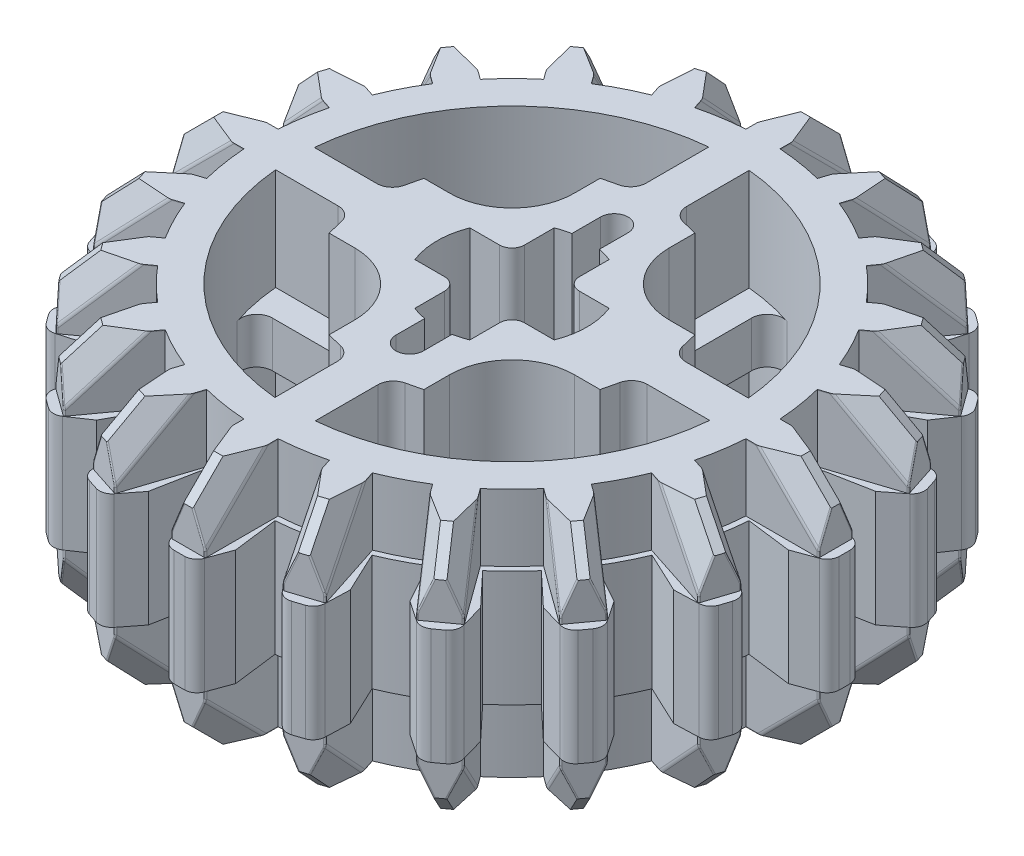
SolidWorks part; units mm, degrees
ref_plane "정면" through (0, 0, 0) normal (0, 0, 1) x (1, 0, 0)
ref_plane "윗면" through (0, 0, 0) normal (0, 1, 0) x (1, 0, 0)
ref_plane "우측면" through (0, 0, 0) normal (1, 0, 0) x (0, 0, -1)
imported_body "불러온 피처3"
sketch "스케치1" plane through (0, -4, 0) normal (0, -1, 0) x (1, 0, 0)
  line L0 (2.2328, 0.88) -> (0.88, 0.88)
  line L1 (0.88, 0.88) -> (0.88, 2.2328)
  line L2 (0.44, 2.3593) -> (0.44, 3.28)
  line L3 (-0.44, 3.28) -> (-0.44, 2.3593)
  line L4 (-0.88, 2.2328) -> (-0.88, 0.88)
  line L5 (-0.88, 0.88) -> (-2.2328, 0.88)
  line L6 (-2.2328, -0.88) -> (-0.88, -0.88)
  line L7 (-0.88, -0.88) -> (-0.88, -2.2328)
  line L8 (-0.44, -2.3593) -> (-0.44, -3.28)
  line L9 (0.44, -3.28) -> (0.44, -2.3593)
  line L10 (0.88, -2.2328) -> (0.88, -0.88)
  line L11 (0.88, -0.88) -> (2.2328, -0.88)
  arc A0 (2.2328, -0.88) -> (2.2328, 0.88) centre (0, 0) ccw
  arc A1 (0.88, 2.2328) -> (0.44, 2.3593) centre (0, 0) ccw
  arc A2 (0.44, 3.28) -> (-0.44, 3.28) centre (0, 3.28) ccw
  arc A3 (-0.44, 2.3593) -> (-0.88, 2.2328) centre (0, 0) ccw
  arc A4 (-2.2328, 0.88) -> (-2.2328, -0.88) centre (0, 0) ccw
  arc A5 (-0.88, -2.2328) -> (-0.44, -2.3593) centre (0, 0) ccw
  arc A6 (-0.44, -3.28) -> (0.44, -3.28) centre (0, -3.28) ccw
  arc A7 (0.44, -2.3593) -> (0.88, -2.2328) centre (0, 0) ccw
extrude "컷-돌출1" cut sketch "스케치1" against normal through all
sketch "스케치2" plane through (0, 0, 0) normal (0, 1, 0) x (1, 0, 0)
  line L0 (-3.7311, 9.7034) -> (-3.7583, 8.9433)
  line L1 (-3.7583, 8.9433) -> (-3.1403, 7.629)
  line L2 (-4.3262, 7.0247) -> (-5.0262, 8.2973)
  line L3 (-5.0262, 8.2973) -> (-5.6571, 8.7221)
  line L4 (-3.7454, 7.3508) -> (0, 0) construction
  arc A0 (-3.1403, 7.629) -> (-4.3262, 7.0247) centre (0, 0) ccw
  dimension "D1" = 8.25
rib "보강대1" sketch "스케치2" sketch "스케치2" thickness 3.71 extrusion direction parallel to sketch draft on no parameters "D1"=3.71
ref_plane "평면1" through (0, 0, 0) normal (0, -1, 0) x (1, 0, 0)
chamfer "모따기1" distance 0.2862 angle 58.392 20 edges at (9.5772, -3.6886, 3.1118) (8.1469, -3.6886, 5.9191) (5.9191, -3.6886, 8.1469) (3.1118, -3.6886, 9.5772) (0, -3.6886, 10.0701) (-3.1118, -3.6886, 9.5772) (-5.9191, -3.6886, 8.1469) (-10.0701, -3.6886, 0) (-9.5772, -3.6886, -3.1118) (-8.1469, -3.6886, -5.9191) (-5.9191, -3.6886, -8.1469) (-3.1118, -3.6886, -9.5772) (0, -3.6886, -10.0701) (3.1118, -3.6886, -9.5772) (-9.5772, -3.6886, 3.1118) (-8.1469, -3.6886, 5.9191) (8.1469, -3.6886, -5.9191) (5.9191, -3.6886, -8.1469) (9.5772, -3.6886, -3.1118) (10.0701, -3.6886, 0)
chamfer "모따기2" distance 0.3023 angle 60.255 20 edges at (-3.1159, 3.7019, -9.5898) (3.1159, 3.7019, -9.5898) (8.1576, 3.7019, -5.9269) (-8.1576, 3.7019, -5.9269) (9.5898, 3.7019, -3.1159) (10.0834, 3.7019, 0) (9.5898, 3.7019, 3.1159) (8.1576, 3.7019, 5.9269) (-5.9269, 3.7019, -8.1576) (5.9269, 3.7019, -8.1576) (5.9269, 3.7019, 8.1576) (0, 3.7019, -10.0834) (3.1159, 3.7019, 9.5898) (0, 3.7019, 10.0834) (-3.1159, 3.7019, 9.5898) (-5.9269, 3.7019, 8.1576) (-8.1576, 3.7019, 5.9269) (-9.5898, 3.7019, 3.1159) (-10.0834, 3.7019, 0) (-9.5898, 3.7019, -3.1159)
fillet "필렛1" radius 0.05 89 edges at (6.5471, -1.9441, 8.0755) (-8.5968, 2.5701, 5.8296) (-8.0755, 1.9112, 6.5471) (-8.2008, 2.5702, 6.3746) (-2.6914, 2.04, 10.0413) (-8.7176, -2.1102, -5.6632) (-9.9775, 2.5702, 2.8877) (-9.7693, 2.5702, 3.5284) (-5.8309, -2.607, 8.5958) (6.5471, 1.9112, 8.0755) (-10.3815, 2.04, -0.5433) (0.55, 1.9112, 10.3815) (-10.3815, 2.04, 0.5433) (-9.7034, 1.9112, -3.7311) (-6.5471, 1.9112, 8.0755) (-6.3746, 2.5702, 8.2008) (-6.5416, 2.04, 8.0795) (-10.0434, 1.9112, -2.685) (-10.0413, 2.04, -2.6914) (-9.9775, 2.5702, -2.8877) (0.5424, -2.1102, 10.3815) (0.55, -1.9441, 10.3815) (-3.5268, -2.607, -9.7698) (-3.7311, -1.9441, -9.7034) (-5.8296, 2.5701, -8.5968) (-6.5471, 1.9112, -8.0755) (-6.3746, 2.5701, -8.2008) (-3.7311, 1.9112, -9.7034) (-3.5284, 2.5701, -9.7693) (-8.7221, -1.9441, 5.6571) (-0.55, 1.9112, -10.3815) (6.5471, 1.9112, -8.0755) (8.0795, 2.04, -6.5416) (8.0755, 1.9112, -6.5471) (8.7182, 2.04, -5.6626) (8.7221, 1.9112, -5.6571) (8.5958, -2.607, 5.8309) (8.7176, -2.1102, 5.6632) (8.7221, -1.9441, 5.6571) (9.7693, 2.5702, -3.5284) (9.7055, 2.04, -3.7248) (9.7034, 1.9112, -3.7311) (3.5268, -2.607, 9.7698) (10.0413, 2.04, -2.6914) (-2.6922, -2.1102, 10.041) (-9.7698, -2.607, 3.5268) (-9.7034, -1.9441, 3.7311) (10.3815, 1.9112, 0.55) (-10.041, -2.1102, -2.6922) (-10.0434, -1.9441, -2.685) (-6.3732, -2.607, -8.2018) (-6.5471, -1.9441, -8.0755) (-0.55, -1.9441, -10.3815) (8.7221, 1.9112, 5.6571) (-8.0755, -1.9441, 6.5471) (8.0795, 2.04, 6.5416) (3.5284, 2.5702, 9.7693) (5.8296, 2.5702, 8.5968) (5.6571, 1.9112, 8.7221) (-0.55, 1.9112, 10.3815) (-0.5433, 2.04, 10.3815) (-3.5284, 2.5702, 9.7693) (-5.8296, 2.5702, 8.5968) (3.7311, 1.9112, -9.7034) (2.685, 1.9112, -10.0434) (3.7311, -1.9441, -9.7034) (2.685, -1.9441, -10.0434) (6.5471, -1.9441, -8.0755) (5.6571, -1.9441, -8.7221) (5.6632, -2.1102, -8.7176) (5.8309, -2.607, -8.5958) (8.7221, -1.9441, -5.6571) (9.7698, -2.607, 3.5268) (9.7034, -1.9441, 3.7311) (8.0755, -1.9441, 6.5471) (5.6571, -1.9441, 8.7221) (10.0434, -1.9441, -2.685) (2.685, -1.9441, 10.0434) (-0.3352, -2.607, 10.3815) (-0.55, -1.9441, 10.3815) (-6.5409, -2.1102, 8.08) (-10.041, -2.1102, 2.6922) (10.3815, -2.607, 0.3352) (-9.7698, -2.607, -3.5268) (-8.0755, -1.9441, -6.5471) (-5.8309, -2.607, -8.5958) (-2.6922, -2.1102, -10.041) (10.0434, -1.9441, 2.685) (9.977, -2.607, 2.8893)
fillet "필렛2" radius 0.4 44 edges at (10.273, 0, 2.8648) (-8.885, 0, 5.8991) (0.45, 0, 10.6555) (-10.6555, 0, 0.45) (8.885, 0, -5.8991) (-2.8648, 0, 10.273) (-10.6555, 0, -0.45) (3.7207, 0, 9.9949) (10.6555, 0, 0.45) (-6.6272, 0, -8.356) (10.6555, 0, -0.45) (-10.273, 0, -2.8648) (-5.8991, 0, -8.885) (-0.45, 0, -10.6555) (5.8991, 0, 8.885) (6.6272, 0, 8.356) (-8.356, 0, 6.6272) (2.8648, 0, -10.273) (-9.9949, 0, 3.7207) (10.273, 0, -2.8648) (-3.7207, 0, -9.9949) (9.9949, 0, -3.7207) (-2.8648, 0, -10.273) (-0.45, 0, 10.6555) (-10.273, 0, 2.8648) (-8.885, 0, -5.8991) (0.88, 0, 0.88) (-0.88, 0, -0.88) (6.6272, 0, -8.356) (-6.6272, 0, 8.356) (8.356, 0, 6.6272) (-0.88, 0, 0.88) (5.8991, 0, -8.885) (0.88, 0, -0.88) (-8.356, 0, -6.6272) (-5.8991, 0, 8.885) (0.45, 0, -10.6555) (8.356, 0, -6.6272) (-9.9949, 0, -3.7207) (3.7207, 0, -9.9949) (-3.7207, 0, 9.9949) (8.885, 0, 5.8991) (2.8648, 0, 10.273) (9.9949, 0, 3.7207)
fillet "필렛3" radius 0.5 16 edges at (0.6478, 2.3662, 4.5549) (-4.5574, -2.3662, 0.62) (4.5574, -2.3662, 0.62) (-0.6478, 2.3662, -4.5549) (-4.5574, -2.3662, -0.62) (-4.5574, 2.3662, 0.62) (4.5574, 2.3662, -0.62) (-0.6478, -2.3662, -4.5549) (0.6478, -2.3662, -4.5549) (4.5574, 2.3662, 0.62) (-0.6478, 2.3662, 4.5549) (-4.5574, 2.3662, -0.62) (0.6478, 2.3662, -4.5549) (0.6478, -2.3662, 4.5549) (-0.6478, -2.3662, 4.5549) (4.5574, -2.3662, -0.62)
fillet "필렛5" radius 2 4 edges at (1.52, 0, 1.52) (1.52, 0, -1.52) (-1.52, 0, 1.52) (-1.52, 0, -1.52)
pattern_circular "원형 패턴1" count 20 over 360 about axis through (0, 0, 0) along (0, 1, 0) of "보강대1"
